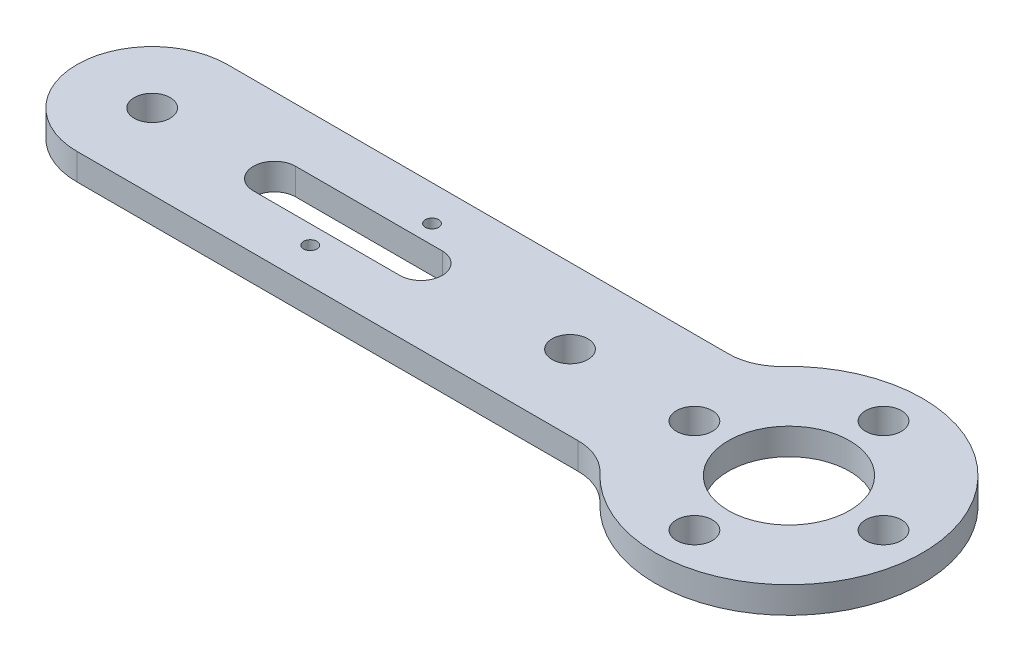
SolidWorks part; units mm, degrees
ref_plane "Front" through (0, 0, 0) normal (0, 0, 1) x (1, 0, 0)
ref_plane "Top" through (0, 0, 0) normal (0, 1, 0) x (1, 0, 0)
ref_plane "Right" through (0, 0, 0) normal (1, 0, 0) x (0, 0, -1)
sketch "Sketch1" plane through (0, 0, 0) normal (0, 1, 0) x (1, 0, 0)
  line L0 (-76.2, 9) -> (-13.2288, 9)
  line L1 (-13.2288, 9) -> (-13.2288, -9) construction
  line L2 (-13.2288, -9) -> (-76.2, -9)
  arc A0 (-13.2288, -9) -> (-13.2288, 9) centre (0, 0) ccw
  circle A1 centre (0, 0) radius 7.25
  arc A2 (-76.2, 9) -> (-76.2, -9) centre (-76.2, 0) ccw
  dimension "D1" = 16
  dimension "D2" = 14.5
  dimension "D3" = 18
  dimension "D4" = 76.2
extrude "Boss-Extrude1" add sketch "Sketch1" along normal blind 3.175
hole_wizard "M4 Clearance Hole1" positions "Sketch4" profile "Sketch5" hole size "M4" standard "ANSI Metric"
sketch "Sketch4" plane through (0, 3.175, 0) normal (0, 1, 0) x (1, 0, 0)
  circle A0 centre (0, 0) radius 11.3137
  point P0 (0, 11.3137)
  point P5 (0, -11.3137)
  point P7 (11.3137, 0)
  point P9 (-11.3137, 0)
  dimension "D1" = 16
sketch "Sketch5" plane through (0, 3.175, -11.3137) normal (1, 0, 0) x (0, 0, 1)
  line L0 (0, 0) -> (0, 3.175)
  line L1 (0, 3.175) -> (2.15, 3.175)
  line L2 (2.15, 3.175) -> (2.15, 0)
  line L5 (2.15, 0) -> (0, 0)
  line L11 (0, -6.35) -> (0, 107.95) construction
  dimension "Thru Hole Dia." = 4.3
  dimension "Thru Hole Depth" = 3.175
hole_wizard "M4 Clearance Hole2" positions "Sketch6" profile "Sketch7" hole size "M4" standard "ANSI Metric"
sketch "Sketch6" plane through (0, 3.175, 0) normal (0, 1, 0) x (1, 0, 0)
  point P0 (-76.2, 0)
  point P3 (-26.2, 0)
  dimension "D1" = 50
sketch "Sketch7" plane through (-76.2, 3.175, 0) normal (1, 0, 0) x (0, 0, 1)
  line L0 (0, 0) -> (0, 3.175)
  line L1 (0, 3.175) -> (2.15, 3.175)
  line L2 (2.15, 3.175) -> (2.15, 0)
  line L5 (2.15, 0) -> (0, 0)
  line L11 (0, -6.35) -> (0, 107.95) construction
  dimension "Thru Hole Dia." = 4.3
  dimension "Thru Hole Depth" = 3.175
fillet "Fillet1" radius 6.35 2 edges at (-13.2288, 1.5875, 9) (-13.2288, 1.5875, -9)
sketch "Sketch8" plane through (0, 3.175, 0) normal (0, 1, 0) x (1, 0, 0)
  line L0 (-44.0269, 0) -> (-61.5611, 0) construction
  line L1 (-44.0269, -2.54) -> (-61.5611, -2.54)
  line L2 (-44.0269, 2.54) -> (-61.5611, 2.54)
  line L3 (-26.2, 0) -> (-76.2, 0) construction
  arc A0 (-44.0269, -2.54) -> (-44.0269, 2.54) centre (-44.0269, 0) ccw
  arc A1 (-61.5611, 2.54) -> (-61.5611, -2.54) centre (-61.5611, 0) ccw
  circle A4 centre (-76.2, 0) radius 2.15 construction
  circle A5 centre (-26.2, 0) radius 2.15 construction
  point P2 (-52.794, 0)
  dimension "D1" = 52.794
  dimension "D2" = 5.08
extrude "Cut-Extrude1" cut sketch "Sketch8" against normal through all
hole_wizard "M2x0.4 Tapped Hole1" positions "Sketch9" profile "Sketch10" tap size "M2x0.4" standard "ANSI Metric"
sketch "Sketch9" plane through (0, 3.175, 0) normal (0, 1, 0) x (1, 0, 0)
  point P0 (-47.4813, 4.7622)
  point P2 (-52.5207, -4.7628)
sketch "Sketch10" plane through (-47.4813, 3.175, -4.7622) normal (1, 0, 0) x (0, 0, 1)
  line L0 (0, 0) -> (0, 3.175)
  line L1 (0, 3.175) -> (0.8, 3.175)
  line L2 (0.8, 3.175) -> (0.8, 0)
  line L5 (0.8, 0) -> (0, 0)
  line L11 (0, -6.35) -> (0, 107.95) construction
  dimension "Thru Tap Drill Dia." = 1.6
  dimension "Thru Tap Drill Depth" = 3.175
other "Freeze***"
